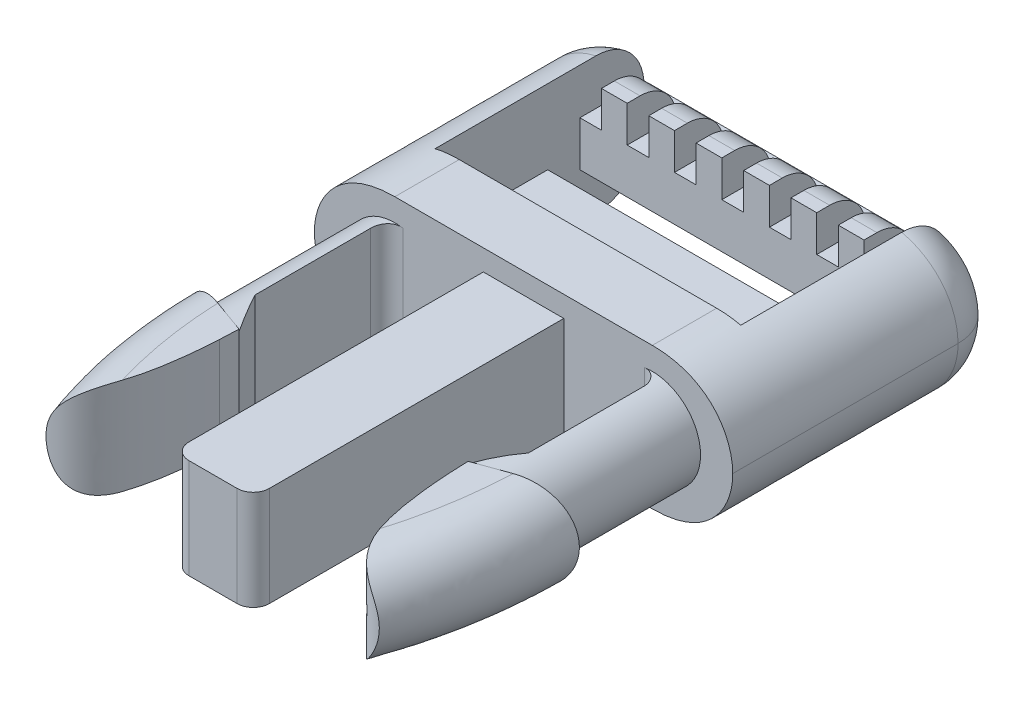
SolidWorks part; units mm, degrees
ref_plane "Piano frontale" through (0, 0, 0) normal (0, 0, 1) x (1, 0, 0)
ref_plane "Piano superiore" through (0, 0, 0) normal (0, 1, 0) x (1, 0, 0)
ref_plane "Piano destro" through (0, 0, 0) normal (1, 0, 0) x (0, 0, -1)
sketch "Schizzo1" plane through (0, 0, 0) normal (0, 0, 1) x (1, 0, 0)
  line B0 (-8, 0) -> (8, 0) construction
  line B1 (-8, 4.4) -> (8, 4.4)
  line B2 (-8, -4.4) -> (8, -4.4)
  line B3 (0, 15.06) -> (0, -12.592) construction
  line B4 (-13, 15.06) -> (-13, -16.3947) construction
  line B5 (-22.0805, 0) -> (21.6781, 0) construction
  spline B6 degree 3 poles (-13, 0) (-13.0039, 1.9698) (-11.5386, 4.4) (-8, 4.4) knots 0 0 0 0 1 1 1 1
  spline B7 degree 3 poles (-13, 0) (-13.0039, -1.9698) (-11.5386, -4.4) (-8, -4.4) knots 0 0 0 0 1 1 1 1
  spline B8 degree 3 poles (13, 0) (13.0039, -1.9698) (11.5386, -4.4) (8, -4.4) knots 0 0 0 0 1 1 1 1
  spline B9 degree 3 poles (13, 0) (13.0039, 1.9698) (11.5386, 4.4) (8, 4.4) knots 0 0 0 0 1 1 1 1
sketch_block_instance "Blocco1-1"
sketch_block "Blocco1"
extrude "Estrusione-Estrusione1" add sketch "Schizzo1" along normal blind 17
sketch "Schizzo2" plane through (0, 4.4, 0) normal (0, 1, 0) x (1, 0, 0)
  line L0 (0, 6.7772) -> (0, -30.0189) construction
  line L1 (8, 0) -> (-8, 0) construction
  line L2 (-9.5, -4) -> (9.5, -4)
  line L3 (-9.5, -4) -> (-9.5, -6)
  line L4 (-9.5, -6) -> (9.5, -6)
  line L5 (9.5, -4) -> (9.5, -6)
  line L6 (-9.5, -4) -> (9.5, -6) construction
  line L7 (-9.5, -6) -> (9.5, -4) construction
  line L8 (-9.5, -10) -> (9.5, -10)
  line L9 (-9.5, -10) -> (-9.5, -13)
  line L10 (-9.5, -13) -> (9.5, -13)
  line L11 (9.5, -10) -> (9.5, -13)
  line L12 (-9.5, -10) -> (9.5, -13) construction
  line L13 (-9.5, -13) -> (9.5, -10) construction
  point P3 (0, -5)
  point P8 (0, -11.5)
  dimension "D1" = 19
  dimension "D2" = 4
  dimension "D3" = 2
  dimension "D4" = 3
  dimension "D5" = 4
extrude "Taglio-Estrusione1" cut sketch "Schizzo2" against normal blind 10
fillet "Raccordo2" radius 3 6 edges at (0, -4.4, 0) (0, 4.4, 0)
sketch "Schizzo3" plane through (0, 0, 0) normal (0, 0, -1) x (-1, 0, 0)
  line L0 (0, 7.8753) -> (0, -7.8753) construction
  line L1 (8, 1.4) -> (-8, 1.4) construction
  line L2 (-9.5, 5.2464) -> (9.5, 5.2464)
  line L3 (-9.5, 5.2464) -> (-9.5, 1.4)
  line L4 (-9.5, 1.4) -> (9.5, 1.4)
  line L5 (9.5, 5.2464) -> (9.5, 1.4)
  line L6 (-9.5, 5.2464) -> (9.5, 1.4) construction
  line L7 (-9.5, 1.4) -> (9.5, 5.2464) construction
  line L8 (-13.9218, 0) -> (14.0837, 0) construction
  line L9 (-9.5, -1.4) -> (9.5, -1.4)
  line L10 (9.5, -5.2464) -> (9.5, -1.4)
  line L11 (-9.5, -5.2464) -> (9.5, -5.2464)
  line L12 (-9.5, -5.2464) -> (-9.5, -1.4)
  point P3 (0, 3.3232)
  dimension "D1" = 19
extrude "Taglio-Estrusione2" cut sketch "Schizzo3" against normal blind 6
sketch "Schizzo4" plane through (9.5, 0, 0) normal (-1, 0, 0) x (0, 0, 1)
  line L0 (4, 1.4) -> (0.0177, 1.4) construction
  line L1 (4, -1.4) -> (4, 1.4) construction
  line L2 (4, 1.4) -> (4, 3.65)
  line L3 (3.2, 3.65) -> (4, 3.65)
  line L4 (0.95, 1.4) -> (4, 1.4)
  arc A0 (3.2, 3.65) -> (0.95, 1.4) centre (3.2, 1.4) ccw
  dimension "D1" = 4.5
  dimension "D2" = 0.8
extrude "Estrusione-Estrusione2" add sketch "Schizzo4" along normal up to surface (19 mm away)
sketch "Schizzo5" plane through (0, 0, 0) normal (0, 0, -1) x (-1, 0, 0)
  line L0 (0, 7.9709) -> (0, -8.0668) construction
  line L1 (8, 1.4) -> (-8, 1.4) construction
  line L2 (-9.5, 5.2883) -> (-8.16, 5.2883)
  line L3 (-9.5, 5.2883) -> (-9.5, 1.4)
  line L4 (-9.5, 1.4) -> (-8.16, 1.4)
  line L5 (-8.16, 5.2883) -> (-8.16, 1.4)
  line L6 (9.5, 1.4) -> (-9.5, 1.4) construction
  line L7 (-6.56, 5.2881) -> (-5.22, 5.2881)
  line L8 (-6.56, 5.2881) -> (-6.56, 1.4)
  line L9 (-6.56, 1.4) -> (-5.22, 1.4)
  line L10 (-5.22, 5.2881) -> (-5.22, 1.4)
  line L11 (-9.5, 1.4) -> (-9.5, 3.65) construction
  line L12 (-3.62, 5.2883) -> (-2.28, 5.2883)
  line L13 (-3.62, 5.2883) -> (-3.62, 1.4)
  line L14 (-3.62, 1.4) -> (-2.28, 1.4)
  line L15 (-2.28, 5.2883) -> (-2.28, 1.4)
  line L16 (-0.68, 5.2883) -> (0.68, 5.2883)
  line L17 (-0.68, 5.2883) -> (-0.68, 1.4)
  line L18 (-0.68, 1.4) -> (0.68, 1.4)
  line L19 (0.68, 5.2883) -> (0.68, 1.4)
  line L20 (3.62, 1.4) -> (2.28, 1.4)
  line L21 (2.28, 5.2883) -> (2.28, 1.4)
  line L22 (3.62, 5.2883) -> (2.28, 5.2883)
  line L23 (3.62, 5.2883) -> (3.62, 1.4)
  line L24 (6.56, 1.4) -> (5.22, 1.4)
  line L25 (5.22, 5.2881) -> (5.22, 1.4)
  line L26 (6.56, 5.2881) -> (5.22, 5.2881)
  line L27 (6.56, 5.2881) -> (6.56, 1.4)
  line L28 (9.5, 1.4) -> (8.16, 1.4)
  line L29 (8.16, 5.2883) -> (8.16, 1.4)
  line L30 (9.5, 5.2883) -> (8.16, 5.2883)
  line L31 (9.5, 5.2883) -> (9.5, 1.4)
  point P23 (0, 5.2883)
  dimension "D1" = 1.6
  dimension "D2" = 1.6
  dimension "D3" = 1.6
  dimension "D4" = 1.34
  dimension "D5" = 1.34
  dimension "D6" = 1.34
extrude "Taglio-Estrusione3" cut sketch "Schizzo5" against normal blind 6
sketch "Schizzo6" plane through (0, 0, 6) normal (0, 0, -1) x (-1, 0, 0)
  line L0 (-9.5, -4.2352) -> (-9.5, 4.2352) construction
  line L1 (-9.5, -3.4) -> (9.5, -3.4)
  line L2 (-9.5, -3.4) -> (-9.5, -6.6764)
  line L3 (-9.5, -6.6764) -> (9.5, -6.6764)
  line L4 (9.5, -3.4) -> (9.5, -6.6764)
  line L5 (8, -4.4) -> (-8, -4.4) construction
  line L7 (-9.5, 4.9747) -> (9.5, 4.9747)
  line L8 (-9.5, 4.9747) -> (-9.5, -0.4)
  line L9 (-9.5, -0.4) -> (9.5, -0.4)
  line L10 (9.5, 4.9747) -> (9.5, -0.4)
  point P6 (0, -3.4)
  point P14 (0, -0.4)
  dimension "D1" = 1
  dimension "D2" = 3
extrude "Taglio-Estrusione4" cut sketch "Schizzo6" against normal blind 6
sketch "Schizzo7" plane through (0, 0, 17) normal (0, 0, 1) x (1, 0, 0)
  line L0 (-15.6421, 0) -> (15.4503, 0) construction
  line L1 (0, 7.5931) -> (0, -5.93) construction
  circle A0 centre (-8, 0) radius 3
  circle A1 centre (8, 0) radius 3
  dimension "D1" = 6
  dimension "D2" = 8
ref_plane "Piano1" through (0, 0, 25.2) normal (0, 0, 1) x (1, 0, 0)
sketch "Schizzo8" plane through (0, 0, 25.2) normal (0, 0, 1) x (1, 0, 0)
  line L0 (-15.6421, 0) -> (15.4503, 0) construction
  line L1 (-9.2, 3) -> (-3.5097, 3)
  line L2 (-3.5097, 3) -> (-3.5097, -3)
  line L3 (-3.5097, -3) -> (-9.2, -3)
  line L4 (0, 8.8428) -> (0, -7.393) construction
  arc A0 (-9.2, 3) -> (-9.2, -3) centre (-9.2, 0) ccw
  dimension "D1" = 6
  dimension "D2" = 1.2
sketch "Schizzo9" plane through (0, 0, 0) normal (0, 1, 0) x (1, 0, 0)
  line L0 (0, -41.9525) -> (0, 6.8354) construction
  spline S0 degree 3 poles (-9.5, -25.2) (-9.5379, -28.718) (-8.7379, -33.78) (-6.5805, -38.3912) (-5.6672, -39.9034) knots 0 0 0 0 0.658946 1 1 1 1
sweep "Sweep1" add profiles "Schizzo8" path "Schizzo9"
sketch "Schizzo10" plane through (0, 0, 25.2) normal (0, 0, 1) x (1, 0, 0)
  line L0 (0, 9.0192) -> (0, -10.3054) construction
  line L3 (9.2, -3) -> (3.5097, -3)
  line L4 (3.5097, -3) -> (3.5097, 3)
  line L5 (3.5097, 3) -> (9.2, 3)
  arc A1 (9.2, 3) -> (9.2, -3) centre (9.2, 0) cw
sketch "Schizzo11" plane through (0, 0, 0) normal (0, 1, 0) x (1, 0, 0)
  line L0 (0, -45.2758) -> (0, -11.1071) construction
  spline S1 degree 3 poles (-80.581, -1239.3908) (2827.6632, 1407.2551) (-1045.6769, -211.9363) (367.979, -74.8471) (2868.4337, 803.0377) knots -46.312494 -46.312494 -46.312494 -46.312494 0.658946 16.098221 16.098221 16.098221 16.098221 only from (-9.5, -25.2) to (-5.6672, -39.9034) construction
  spline S2 degree 3 poles (-9.5, -25.2) (-9.5379, -28.718) (-8.7379, -33.78) (-6.5805, -38.3912) (-5.6672, -39.9034) knots 0 0 0 0 0.658946 1 1 1 1
  spline S3 degree 3 poles (9.5, -25.2) (9.5379, -28.718) (8.7379, -33.78) (6.5805, -38.3912) (5.6672, -39.9034) knots 0 0 0 0 0.658946 1 1 1 1
  point P4 (0, 0)
sweep "Sweep3" add profiles "Schizzo10" path "Schizzo11"
sketch "Schizzo15" plane through (0, -3, 0) normal (0, -1, 0) x (1, 0, 0)
  line L0 (-12.6097, 25.5839) -> (-7.1166, 27.5673)
  line L2 (-10.3572, 36.3225) -> (-10.3572, 27.1259) construction
  line L6 (-10.3572, 36.3225) -> (-10.3572, 44.9798)
  line L9 (0, 45.9691) -> (0, -0.9833) construction
  line L14 (-10.3572, 44.9798) -> (10.3572, 44.9798)
  line L19 (-12.6097, 22.8932) -> (12.6097, 22.8932)
  line L20 (10.3572, 36.3225) -> (10.3572, 27.1259) construction
  line L24 (-12.6097, 22.8932) -> (-12.6097, 25.5839)
  line L25 (12.6097, 22.8932) -> (12.6097, 25.5839)
  line L26 (10.3572, 36.3225) -> (10.3572, 44.9798)
  line L27 (12.6097, 25.5839) -> (7.1166, 27.5673)
  spline S1 degree 3 poles (-10.3572, 36.3225) (-8.5259, 36.4286) (-7.297, 33.6632) (-7.1166, 27.5673) knots 0 0 0 0 0.978183 0.978183 0.978183 0.978183
  spline S2 degree 3 number of poles 123 (-7.9632, 41.3241) -> (-12.2, 25.2) construction
  spline S4 degree 3 poles (10.3572, 36.3225) (8.5259, 36.4286) (7.297, 33.6632) (7.1166, 27.5673) knots 0 0 0 0 0.978183 0.978183 0.978183 0.978183
  point P15 (0, 22.8932)
  point P22 (0, 22.8932)
  point P23 (0, 44.9798)
  point P24 (0, 44.9798)
extrude "Taglio-Estrusione5" cut sketch "Schizzo15" against normal blind 8 contours S4 L27 L25 L19 L24 L0 S1 L6 L14 L26
extrude "Estrusione-Estrusione4" add sketch "Schizzo7" along normal blind 11
sketch "Schizzo17" plane through (0, 0, 0) normal (0, 1, 0) x (1, 0, 0)
  line L0 (0, -47.7792) -> (0, 9.0499) construction
  line L1 (-8.5, -30.8272) -> (-8.5, -15.8119) construction
  line L3 (-7.1166, -27.5673) -> (-8.5, -25.2)
  line L5 (-4.84, -25.2) -> (4.84, -25.2) construction
  line L6 (-8.5, -25.2) -> (-8.5, -18)
  line L7 (-7.5, -17) -> (-3.3508, -17)
  line L8 (-8, -17) -> (8, -17) construction
  line L9 (-7.1662, -28.7365) -> (-3.3508, -28.7365)
  line L10 (-3.3508, -28.7365) -> (-3.3508, -17)
  line L11 (8.5, -30.8272) -> (8.5, -15.8119) construction
  line L12 (3.3508, -28.7365) -> (3.3508, -17)
  line L13 (7.1662, -28.7365) -> (3.3508, -28.7365)
  line L14 (7.5, -17) -> (3.3508, -17)
  line L15 (8.5, -25.2) -> (8.5, -18)
  line L16 (7.1166, -27.5673) -> (8.5, -25.2)
  arc A0 (-7.5, -17) -> (-8.5, -18) centre (-7.5, -18) ccw
  arc A1 (7.5, -17) -> (8.5, -18) centre (7.5, -18) cw
  spline S1 degree 3 poles (-7.1166, -27.5673) (-7.1374, -28.1162) (-7.1429, -28.2151) (-7.1662, -28.7365) knots 0 0 0 0 1 1 1 1
  spline S2 degree 3 poles (7.1166, -27.5673) (7.1374, -28.1162) (7.1429, -28.2151) (7.1662, -28.7365) knots 0 0 0 0 1 1 1 1
  spline S3 degree 3 poles (-7.9948, -33.9312) (-7.5074, -32.4913) (-7.2, -30.3851) (-7.1166, -27.5673) knots 0.526021 0.526021 0.526021 0.526021 0.978183 0.978183 0.978183 0.978183 construction
  point P23 (-8.5, -17)
  point P32 (8.5, -17)
  dimension "D2" = 1
  dimension "D1" = 8.5
extrude "Taglio-Estrusione6" cut sketch "Schizzo17" against normal mid plane 9
sketch "Schizzo18" plane through (0, 0, 17) normal (0, 0, 1) x (1, 0, 0)
  line L1 (-2.5, 3.1) -> (2.5, 3.1)
  line L2 (-2.5, 3.1) -> (-2.5, -3.1)
  line L3 (-2.5, -3.1) -> (2.5, -3.1)
  line L4 (2.5, 3.1) -> (2.5, -3.1)
  line L5 (-2.5, 3.1) -> (2.5, -3.1) construction
  line L6 (-2.5, -3.1) -> (2.5, 3.1) construction
  point P0 (0, 0)
  dimension "D1" = 5
  dimension "D2" = 6.2
extrude "Estrusione-Estrusione5" add sketch "Schizzo18" along normal blind 19.3
fillet "Raccordo3" radius 1 2 edges at (2.5, 0, 36.3) (-2.5, 0, 36.3)
